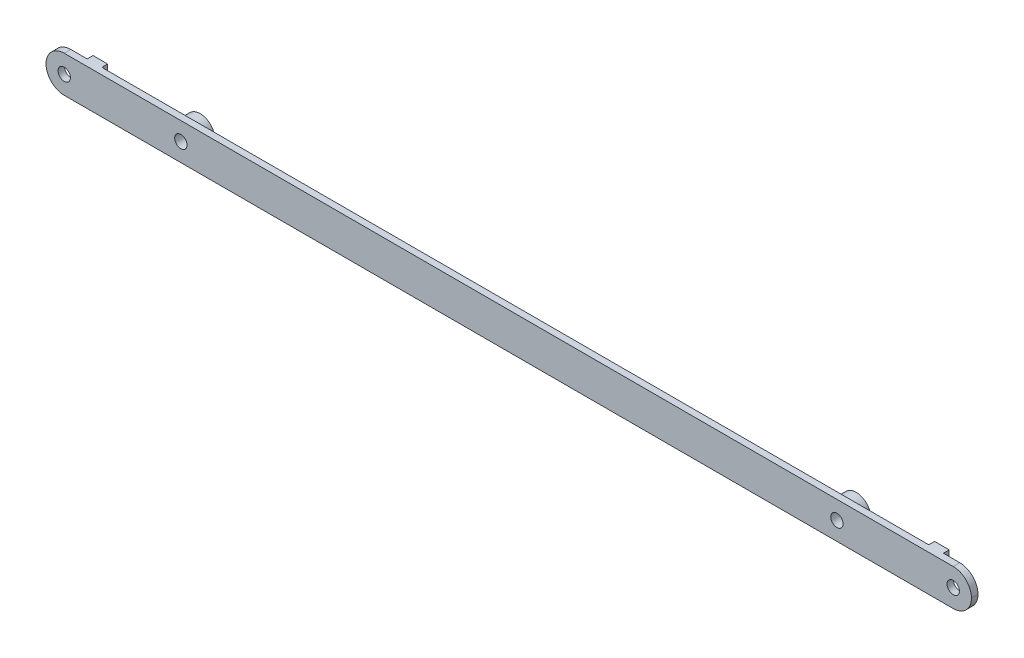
SolidWorks part; units mm, degrees
ref_plane "Front" through (0, 0, 0) normal (0, 0, 1) x (1, 0, 0)
ref_plane "Top" through (0, 0, 0) normal (0, 1, 0) x (1, 0, 0)
ref_plane "Right" through (0, 0, 0) normal (1, 0, 0) x (0, 0, -1)
sketch "Sketch1" plane through (0, 0, 0) normal (0, 0, 1) x (1, 0, 0)
  line L0 (-89.246, 4.2771) -> (-89.246, -5.7229)
  line L1 (-94.346, 4.2771) -> (154.654, 4.2771)
  line L2 (-94.346, 4.2771) -> (-94.346, -5.7229)
  line L3 (-94.346, -5.7229) -> (154.654, -5.7229)
  line L4 (154.654, 4.2771) -> (154.654, -5.7229)
  line L5 (149.554, 4.2771) -> (149.554, -5.7229)
  line L7 (-94.346, -5.7229) -> (-96.796, -5.7229)
  line L8 (-94.346, -5.7229) -> (-94.346, 4.2771)
  line L9 (-94.346, 4.2771) -> (-96.796, 4.2771)
  line L10 (-96.796, -5.7229) -> (-96.796, 4.2771)
  line L11 (154.654, 4.2771) -> (157.104, 4.2771)
  line L12 (154.654, 4.2771) -> (154.654, -5.7229)
  line L13 (154.654, -5.7229) -> (157.104, -5.7229)
  line L14 (157.104, 4.2771) -> (157.104, -5.7229)
  circle A0 centre (-91.796, -0.7229) radius 1.7
  circle A1 centre (152.104, -0.7229) radius 1.7
  dimension "D5" = 2.55
  dimension "D7" = 3.4
  dimension "D8" = 3.4
  dimension "D1" = 249
  dimension "D2" = 10
  dimension "D3" = 5.1
  dimension "D4" = 5.1
  dimension "D6" = 2.55
  dimension "D9" = 5
  dimension "D10" = 5
  dimension "D11" = 5
  dimension "D12" = 5
sketch "Sketch2" plane through (0, 0, 0) normal (0, 0, 1) x (1, 0, 0)
  line L1 (-96.796, -5.7229) -> (157.104, -5.7229)
  line L2 (-96.796, -5.7229) -> (-96.796, 4.2771)
  line L3 (-96.796, 4.2771) -> (157.104, 4.2771)
  line L4 (157.104, -5.7229) -> (157.104, 4.2771)
  circle A0 centre (-91.796, -0.7229) radius 1.7
  circle A1 centre (152.104, -0.7229) radius 1.7
extrude "Boss-Extrude1" add sketch "Sketch2" along normal blind 1.8
fillet "Fillet1" radius 5 4 edges at (157.104, -5.7229, 0.9) (157.104, 4.2771, 0.9) (-96.796, -5.7229, 0.9) (-96.796, 4.2771, 0.9)
sketch "Sketch3" plane through (0, 0, 0) normal (0, 0, 1) x (1, 0, 0)
  line L0 (152.104, 4.2771) -> (-91.796, 4.2771) construction
  circle A0 centre (-59.796, -0.7229) radius 1.7
  circle A1 centre (120.204, -0.7229) radius 1.7
  dimension "D1" = 3.4
  dimension "D2" = 3.4
  dimension "D3" = 5
  dimension "D4" = 5
  dimension "D5" = 180
  dimension "D6" = 32
extrude "Cut-Extrude1" cut sketch "Sketch3" along normal blind 2
sketch "Sketch8" plane through (0, 0, 0) normal (0, 0, 1) x (1, 0, 0)
  circle A0 centre (-59.796, -0.7229) radius 1.7
  circle A1 centre (-59.796, -0.7229) radius 4
  circle A2 centre (120.204, -0.7229) radius 1.7
  circle A3 centre (120.204, -0.7229) radius 4
  dimension "D1" = 8
  dimension "D2" = 8
extrude "Boss-Extrude2" add sketch "Sketch8" against normal blind 3.5
hole_wizard "CSK for M3 Flat Head Machine Screw3" positions "Sketch9" profile "Sketch10" countersink size "M3" standard "ANSI Metric"
sketch "Sketch9" plane through (0, 0, -3.5) normal (0, 0, -1) x (-1, 0, 0)
  point P0 (59.796, -0.7229)
  point P3 (-120.204, -0.7229)
sketch "Sketch10" plane through (-59.796, -0.7229, -3.5) normal (1, 0, 0) x (0, 1, 0)
  line L0 (0, 0) -> (0, 4.0215)
  line L1 (0, 4.0215) -> (1.7, 3)
  line L2 (1.7, 3) -> (1.7, 1.45)
  line L3 (1.7, 1.45) -> (3.15, 0)
  line L5 (3.15, 0) -> (0, 0)
  line L6 (-1.7, 1.45) -> (-3.15, 0) construction
  line L10 (0, 4.0215) -> (-1.7, 3) construction
  line L11 (0, -6.35) -> (0, 107.95) construction
  dimension "Hole Dia." = 3.4
  dimension "Hole Depth" = 3
  dimension "Near C'Sink Dia." = 6.3
  dimension "Near C'Sink Angle" = 90
  dimension "Drill Angle" = 118
sketch "Sketch11" plane through (0, 0, 0) normal (0, 0, 1) x (1, 0, 0)
  line L1 (-61.196, 0.2415) -> (-58.396, 0.2415)
  line L2 (-61.196, 0.2415) -> (-61.196, 6.2534)
  line L3 (-61.196, 6.2534) -> (-58.396, 6.2534)
  line L4 (-58.396, 0.2415) -> (-58.396, 6.2534)
  line L5 (118.804, 0.2415) -> (121.604, 0.2415)
  line L6 (118.804, 0.2415) -> (118.804, 6.2463)
  line L7 (118.804, 6.2463) -> (121.604, 6.2463)
  line L8 (121.604, 0.2415) -> (121.604, 6.2463)
  circle A0 centre (-59.796, -0.7229) radius 1.7 construction
  circle A1 centre (120.204, -0.7229) radius 1.7 construction
  dimension "D1" = 2.8
  dimension "D2" = 2.8
sketch "Sketch12" plane through (0, 0, 0) normal (0, 0, 1) x (1, 0, 0)
  line L0 (-91.796, -5.7229) -> (152.104, -5.7229) construction
  line L1 (147.604, -5.7229) -> (143.604, -5.7229)
  line L2 (147.604, -5.7229) -> (147.604, 4.2771)
  line L3 (147.604, 4.2771) -> (143.604, 4.2771)
  line L4 (143.604, -5.7229) -> (143.604, 4.2771)
  line L5 (152.104, 4.2771) -> (-91.796, 4.2771) construction
  line L7 (-87.296, 4.2771) -> (-83.296, 4.2771)
  line L8 (-87.296, 4.2771) -> (-87.296, -5.7229)
  line L9 (-87.296, -5.7229) -> (-83.296, -5.7229)
  line L10 (-83.296, 4.2771) -> (-83.296, -5.7229)
  dimension "D1" = 4.5
  dimension "D2" = 4
  dimension "D3" = 4.5
  dimension "D4" = 4
extrude "Boss-Extrude3" add sketch "Sketch12" against normal blind 1.6
fillet "Fillet2" radius 0.4 4 edges at (-83.296, -0.7229, 0) (116.204, -0.7229, 0) (143.604, -0.7229, 0) (-63.796, -0.7229, 0)
